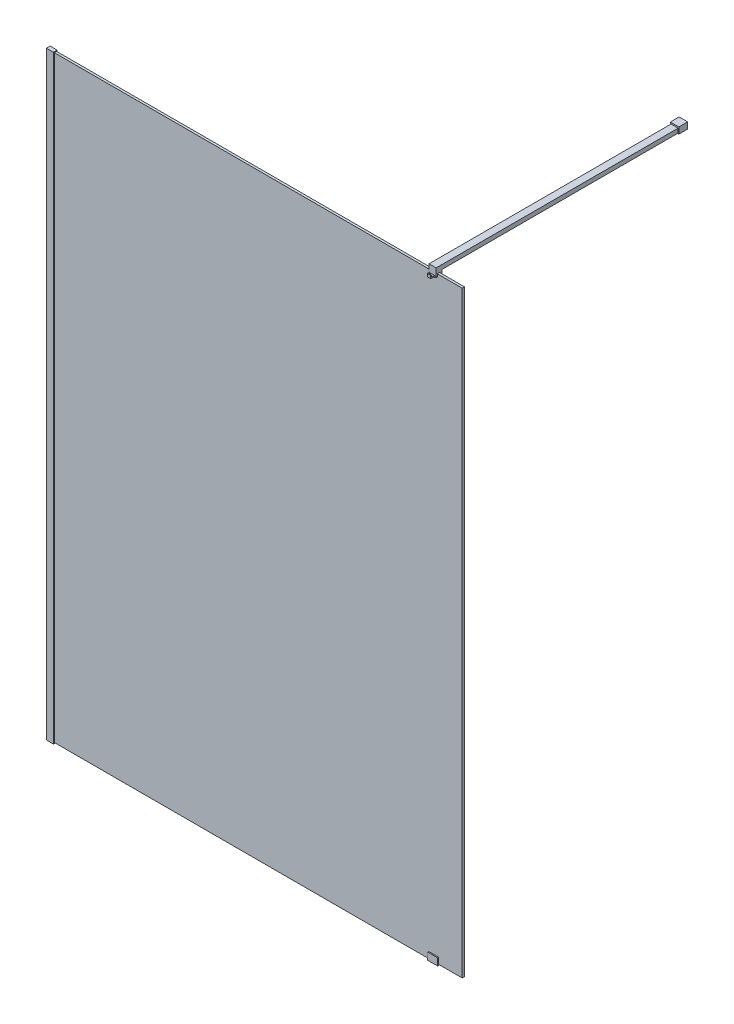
SolidWorks part; units mm, degrees
ref_plane "Płaszczyzna przednia" through (0, 0, 0) normal (0, 0, 1) x (1, 0, 0)
ref_plane "Płaszczyzna górna" through (0, 0, 0) normal (0, 1, 0) x (1, 0, 0)
ref_plane "Płaszczyzna prawa" through (0, 0, 0) normal (1, 0, 0) x (0, 0, -1)
sketch "Szkic1" plane through (0, 0, 0) normal (0, 1, 0) x (1, 0, 0)
  line L0 (0, 0) -> (0, 13.3)
  line L2 (0, 13.3) -> (25, 13.3)
  line L3 (25, 13.3) -> (25, 11.4)
  line L4 (25, 11.4) -> (11.45, 11.4)
  line L5 (11.45, 11.4) -> (11.45, 3.4)
  line L6 (11.45, 3.4) -> (25, 3.4)
  line L7 (25, 3.4) -> (25, 0)
  line L8 (25, 0) -> (0, 0)
  dimension "D1" = 13.3
  dimension "D4" = 1.9
  dimension "D5" = 8
  dimension "D6" = 3.4
  dimension "D7" = 13.55
  dimension "D8" = 25
extrude "Dodanie-wyciągnięcie1" add sketch "Szkic1" along normal blind 2100
sketch "Szkic2" plane through (0, 0, 0) normal (0, -1, 0) x (1, 0, 0)
  line L0 (11.45, -3.4) -> (1458.45, -3.4)
  line L1 (11.45, -3.4) -> (11.45, -11.4)
  line L2 (1458.45, -3.4) -> (1458.45, -11.4)
  line L3 (11.45, -11.4) -> (1458.45, -11.4)
  line L4 (11.45, -11.4) -> (25, -11.4) construction
  dimension "D1" = 1447
extrude "Dodanie-wyciągnięcie2" add sketch "Szkic2" against normal blind 2100 separate body
sketch "Szkic4" plane through (0, 2100, 0) normal (0, 1, 0) x (1, 0, 0)
  line L1 (25, 13.3) -> (0, 13.3) construction
  line L2 (25, 11.4) -> (25, 13.3) construction
  line L3 (0, 13.3) -> (0, 0) construction
  line L5 (0, 0) -> (25, 0) construction
  line L7 (25, 13.3) -> (0, 13.3)
  line L8 (25, 0) -> (25, 13.3)
  line L9 (0, 13.3) -> (0, 0)
  line L11 (0, 0) -> (25, 0)
extrude "Dodanie-wyciągnięcie3" add sketch "Szkic4" along normal blind 3
sketch "Szkic5" plane through (0, 0, 0) normal (0, -1, 0) x (1, 0, 0)
  line L1 (0, 0) -> (25, 0) construction
  line L2 (25, 0) -> (25, -3.4) construction
  line L3 (0, -13.3) -> (0, 0) construction
  line L5 (25, -13.3) -> (0, -13.3) construction
  line L7 (0, 0) -> (25, 0)
  line L8 (25, 0) -> (25, -13.3)
  line L9 (0, -13.3) -> (0, 0)
  line L11 (25, -13.3) -> (0, -13.3)
extrude "Dodanie-wyciągnięcie4" add sketch "Szkic5" along normal blind 3
ref_plane "Płaszczyzna1" through (1358.45, 0, 0) normal (1, 0, 0) x (0, 0, -1)
sketch "Szkic6" plane through (1358.45, 0, 0) normal (1, 0, 0) x (0, 0, -1)
  line L0 (11.4, 22) -> (15.75, 22)
  line L1 (15.75, 22) -> (15.75, -3)
  line L2 (15.75, -3) -> (-0.35, -3)
  line L3 (-0.35, -3) -> (-0.35, 22)
  line L4 (-0.35, 22) -> (3.4, 22)
  line L5 (11.4, 22) -> (11.4, 0)
  line L6 (11.4, 0) -> (11.4, 2100)
  line L7 (11.4, 0) -> (11.4, 2100) construction
  line L8 (3.4, 2100) -> (3.4, 0)
  line L9 (3.4, 2100) -> (3.4, 0) construction
  line L10 (11.4, 0) -> (3.4, 0)
  line L11 (3.4, 0) -> (3.4, 22)
  dimension "D1" = 4.35
  dimension "D2" = 25
  dimension "D3" = 3
  dimension "D4" = 3.75
extrude "Dodanie-wyciągnięcie5" add sketch "Szkic6" along normal mid plane 35 separate body
sketch "Szkic7" plane through (1358.45, 0, 0) normal (1, 0, 0) x (0, 0, -1)
  line L0 (3.4, 2100) -> (3.4, 0) construction
  line L1 (-0.6, 2120) -> (19.4, 2120)
  line L2 (3.4, 2100) -> (3.4, 0) construction
  line L4 (11.4, 2100) -> (3.4, 2100) construction
  line L13 (11.4, 2100) -> (11.4, 0) construction
  line L20 (19.4, 2120) -> (19.4, 2090)
  line L25 (19.4, 2090) -> (11.4, 2090)
  line L26 (11.4, 2090) -> (11.4, 2100)
  line L27 (11.4, 2100) -> (3.4, 2100)
  line L28 (3.4, 2100) -> (3.4, 2090)
  line L29 (3.4, 2090) -> (-13.37, 2090)
  line L30 (-13.37, 2090) -> (-13.37, 2100)
  line L31 (-13.37, 2100) -> (-10.37, 2100)
  line L32 (-10.37, 2100) -> (-9.8451, 2094)
  line L33 (-9.8451, 2094) -> (-0.6, 2094)
  line L34 (-0.6, 2094) -> (-0.6, 2120)
  dimension "D3" = 20
  dimension "D4" = 30
  dimension "D5" = 16.77
  dimension "D6" = 4
  dimension "D14" = 8
  dimension "D21" = 10
  dimension "D22" = 4
  dimension "D23" = 3
  dimension "D24" = 95
extrude "Dodanie-wyciągnięcie6" add sketch "Szkic7" along normal mid plane 25 separate body
sketch "Szkic8" plane through (0, 2100, 0) normal (0, 1, 0) x (1, 0, 0)
  line L0 (1345.95, -0.6) -> (1352.45, -3.631)
  line L1 (1352.45, -3.631) -> (1352.45, -13.37)
  line L2 (1370.95, -0.6) -> (1364.45, -3.631)
  line L3 (1364.45, -3.631) -> (1364.45, -13.37)
  line L4 (1358.45, -10.37) -> (1358.45, 156.6902) construction
  line L5 (1370.95, -10.37) -> (1345.95, -10.37) construction
  line L6 (1352.45, -13.37) -> (1364.45, -13.37)
  line L7 (1370.95, -13.37) -> (1345.95, -13.37) construction
  dimension "D1" = 12
  dimension "D2" = 115
extrude "Wytnij-wyciągnięcie1" cut sketch "Szkic8" against normal through all and the other way through all
sketch "Szkic10" plane through (0, 2120, 0) normal (0, 1, 0) x (1, 0, 0)
  line L0 (1358.45, 31.9) -> (1358.45, 19.4) construction
  line L1 (1345.95, 881.03) -> (1370.95, 881.03)
  line L2 (1345.95, 881.03) -> (1345.95, 19.4)
  line L3 (1345.95, 19.4) -> (1370.95, 19.4)
  line L4 (1370.95, 19.4) -> (1345.95, 19.4) construction
  line L5 (1345.95, 19.4) -> (1345.95, -0.6) construction
  line L6 (1370.95, 881.03) -> (1370.95, 19.4)
  point P4 (1358.45, 31.9)
  dimension "D2" = 861.63
  dimension "D1" = 25
  dimension "D3" = 12.5
extrude "Dodanie-wyciągnięcie7" add sketch "Szkic10" against normal blind 15
sketch "Szkic14" plane through (0, 0, -881.03) normal (0, 0, -1) x (-1, 0, 0)
  line L1 (-1373.45, 2125) -> (-1343.45, 2125)
  line L2 (-1373.45, 2125) -> (-1373.45, 2103)
  line L3 (-1373.45, 2103) -> (-1343.45, 2103)
  line L4 (-1343.45, 2125) -> (-1343.45, 2103)
  line L5 (-1373.45, 2125) -> (-1343.45, 2103) construction
  line L6 (-1373.45, 2103) -> (-1343.45, 2125) construction
  line L7 (-1358.45, 2120) -> (-1358.45, 2114) construction
  line L8 (-1370.95, 2120) -> (-1345.95, 2120) construction
  line L9 (-1370.95, 2105) -> (-1345.95, 2105) construction
  point P0 (-1358.45, 2114)
  dimension "D1" = 30
  dimension "D2" = 22
  dimension "D3" = 2
extrude "Dodanie-wyciągnięcie8" add sketch "Szkic14" against normal blind 31
